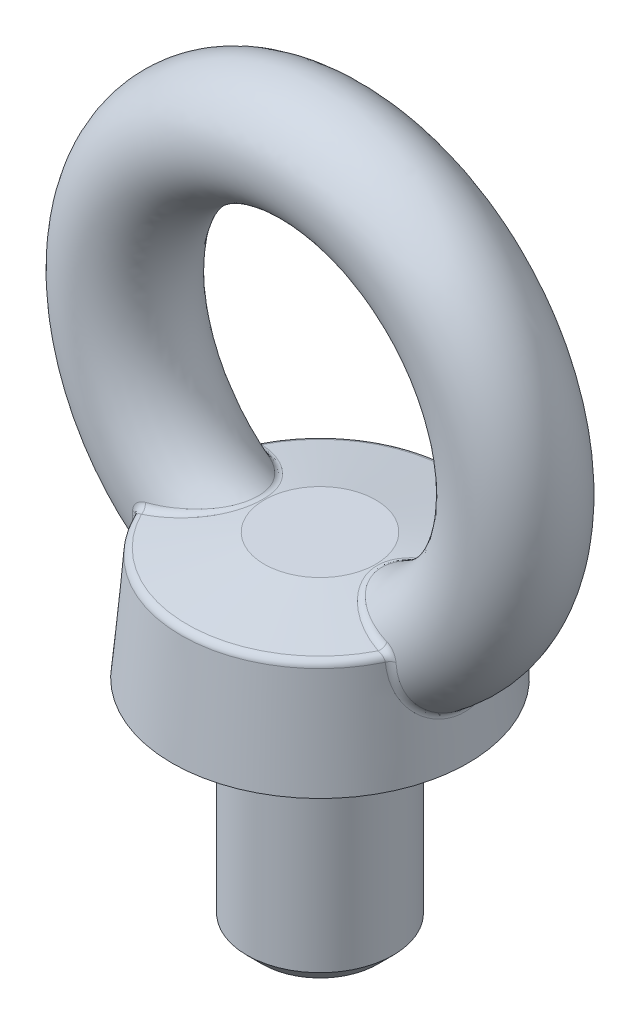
SolidWorks part; units mm, degrees
ref_plane "Front Plane" through (0, 0, 0) normal (0, 0, 1) x (1, 0, 0)
ref_plane "Top Plane" through (0, 0, 0) normal (0, 1, 0) x (1, 0, 0)
ref_plane "Right Plane" through (0, 0, 0) normal (1, 0, 0) x (0, 0, -1)
sketch "Sketch1" plane through (0, 0, 0) normal (0, 0, 1) x (1, 0, 0)
  ellipse E0 centre (0, 73.5) end of major axis (0, 0) minor radius 72
  dimension "D1" = 144
  dimension "D2" = 147
sketch "Sketch2" plane through (0, 0, 0) normal (1, 0, 0) x (0, 0, -1)
  line L3 (0, 147) -> (0, 0) construction
  circle A0 centre (0, 16) radius 16
  point P5 (0, 0)
sweep "Sweep1" add profiles "Sketch2" path "Sketch1"
sketch "Sketch3" plane through (0, 0, 0) normal (1, 0, 0) x (0, 0, -1)
  line L0 (0, 0) -> (-42.5, 0)
  line L1 (-42.5, 0) -> (-39.7004, 32)
  line L2 (-39.7004, 32) -> (-16, 36.179)
  line L3 (-16, 36.179) -> (0, 36.179)
  line L4 (0, 36.179) -> (0, 0)
revolve "Revolve1" add sketch "Sketch3" angle 360 about L4
fillet "Fillet1" radius 2.1 6 edges at (17.3161, 35.9224, -2.2002) (41.3328, 13.3223, -0.3688) (-17.3161, 35.9224, 2.2002) (-41.3328, 13.3223, 0.3688) (0, 32, -39.7004) (0, 32, 39.7004)
sketch "Sketch4" plane through (0, 0, 0) normal (0, -1, 0) x (1, 0, 0)
  circle A0 centre (0, 0) radius 21
  dimension "D1" = 42
extrude "Extrude1" add sketch "Sketch4" along normal blind 63
chamfer "Chamfer1" distance 4.5 angle 45 1 edges at (0, -63, -21)
sketch "Sketch5" plane through (0, 0, 0) normal (1, 0, 0) x (0, 0, -1)
  line L0 (-21, 0) -> (-21, -12.2942)
  line L1 (-21, 0) -> (-21, -58.5) construction
  line L2 (-16.5, -4.5) -> (-21, -12.2942)
  line L3 (-16.5, -4.5) -> (-16.5, -2.25)
  line L4 (-18.75, 0) -> (-21, 0)
  line L5 (-18.75, -2.25) -> (-16.5, -2.25) construction
  arc A1 (-16.5, -2.25) -> (-18.75, 0) centre (-18.75, -2.25) ccw
  point P0 (-16.5, -63)
  dimension "D1" = 30
revolve "Cut-Revolve1" cut sketch "Sketch5" angle 360 about axis through (0, -63, 0) along (0, 1, 0)
equation "\"D4@Sketch3\" = \"D1@Sketch2\""
equation "\"D5@Sketch3\" = \"D1@Sketch2\"/2"
